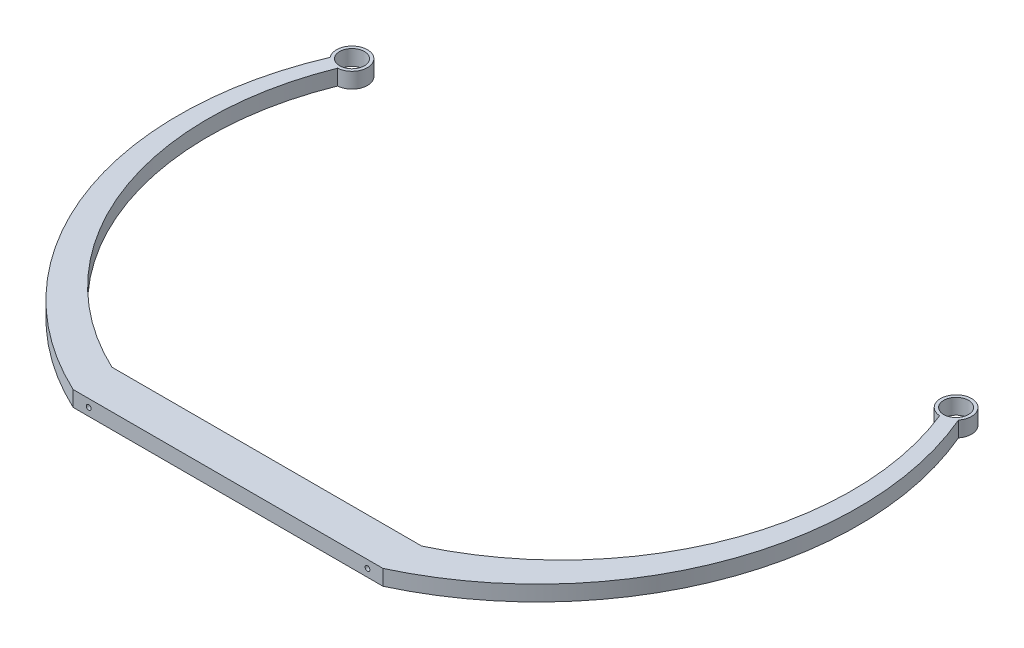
SolidWorks part; units mm, degrees
ref_plane "前视基准面" through (0, 0, 0) normal (0, 0, 1) x (1, 0, 0)
ref_plane "上视基准面" through (0, 0, 0) normal (0, 1, 0) x (1, 0, 0)
ref_plane "右视基准面" through (0, 0, 0) normal (1, 0, 0) x (0, 0, -1)
sketch "草图1" plane through (0, 0, 0) normal (0, 1, 0) x (1, 0, 0)
  line L0 (0, -117.5) -> (0, 132.5) construction
  line L1 (100, -117.5) -> (-100, -117.5)
  line L2 (100, -142.5) -> (-100, -142.5)
  line L3 (100, -117.5) -> (-100, -142.5) construction
  line L4 (100, -142.5) -> (-100, -117.5) construction
  line L5 (190, 132.5) -> (-190, 132.5) construction
  line L6 (200, 132.5) -> (-200, 132.5) construction
  arc A0 (100, -117.5) -> (190, 132.5) centre (20, 52.5) ccw construction
  arc A1 (-100, -117.5) -> (-190, 132.5) centre (-20, 52.5) cw construction
  arc A2 (100, -142.5) -> (200, 132.5) centre (12.5, 45) ccw construction
  arc A3 (-100, -142.5) -> (-200, 132.5) centre (-12.5, 45) cw construction
  circle A4 centre (195, 132.5) radius 10 construction
  circle A5 centre (-195, 132.5) radius 10 construction
  arc A6 (100, -117.5) -> (194.3474, 122.5213) centre (20, 52.5) ccw
  arc A7 (100, -142.5) -> (202.7968, 126.2382) centre (12.5, 45) ccw
  arc A8 (194.3474, 122.5213) -> (202.7968, 126.2382) centre (195, 132.5) cw
  arc A9 (-202.7968, 126.2382) -> (-194.3474, 122.5213) centre (-195, 132.5) cw
  arc A10 (-202.7968, 126.2382) -> (-100, -142.5) centre (-12.5, 45) ccw
  arc A11 (-194.3474, 122.5213) -> (-100, -117.5) centre (-20, 52.5) ccw
  point P0 (0, -130)
  point P10 (0, 132.5)
  point P15 (0, 132.5)
extrude "凸台-拉伸1" add sketch "草图1" along normal blind 10 contours A11 A9 A10 L2 A7 A8 A6 L1
sketch "草图2" plane through (0, 10, 0) normal (0, 1, 0) x (1, 0, 0)
  circle A0 centre (-195, 132.5) radius 8
  circle A1 centre (195, 132.5) radius 8
extrude "切除-拉伸1" cut sketch "草图2" against normal through all
sketch "草图3" plane through (0, 0, 117.5) normal (0, 0, -1) x (-1, 0, 0)
  line L0 (0, 10) -> (0, 0) construction
  line L2 (-100, 10) -> (100, 10) construction
  line L3 (-100, 0) -> (100, 0) construction
  line L4 (-90, 5) -> (90, 5) construction
  circle A0 centre (-90, 5) radius 1.55
  circle A1 centre (90, 5) radius 1.55
  point P3 (0, 10)
  point P11 (0, 5)
extrude "切除-拉伸2" cut sketch "草图3" against normal through all
